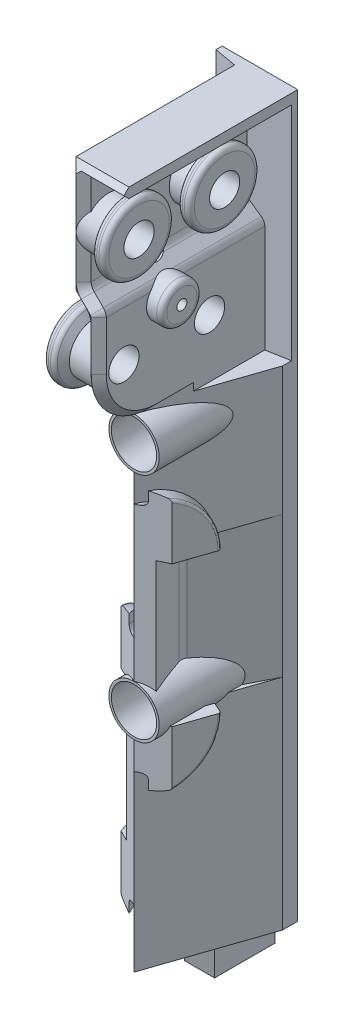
SolidWorks part; units mm, degrees
ref_plane "Plan de face" through (0, 0, 0) normal (0, 0, 1) x (1, 0, 0)
ref_plane "Plan de dessus" through (0, 0, 0) normal (0, 1, 0) x (1, 0, 0)
ref_plane "Plan de droite" through (0, 0, 0) normal (1, 0, 0) x (0, 0, -1)
body saved out of another part "Stock-basBarette-1"
sketch "Esquisse1" plane through (0, 0, -3) normal (0, 0, -1) x (-1, 0, 0)
  line L0 (7.5, -119.9983) -> (-7.5, -119.9983) construction
  line L1 (-3, -119.9983) -> (3, -119.9983)
  line L2 (-3, -119.9983) -> (-3, -125.9983)
  line L3 (-3, -125.9983) -> (3, -125.9983)
  line L4 (3, -119.9983) -> (3, -125.9983)
  line L5 (-7.5, 23) -> (-7.5, -119.9983) construction
  point P6 (0, -119.9983)
  dimension "D1" = 6
  dimension "D2" = 6
  dimension "D3" = 7.5
extrude "Boss.-Extru.1" add sketch "Esquisse1" against normal blind 15
chamfer "Chanfrein1" distance 3 angle 45 3 edges at (-3, -122.9983, 12) (3, -122.9983, 12) (0, -125.9983, 12)
sketch "Esquisse2" plane through (0, 0, -3) normal (0, 0, -1) x (-1, 0, 0)
  line B0 (-2.5194, -116.5814) -> (-2.5194, -84.5637) construction
  line B1 (-2.5194, -74.7572) -> (-2.5194, -29.9757) construction
  line B2 (3.9806, -1.2441) -> (3.9806, 16.0062) construction
sketch_block_instance "Bloc1-1"
sketch_block "Bloc1"
extrude "Enlèv. mat.-Extru.1" cut sketch "Esquisse2" against normal blind 1.5
